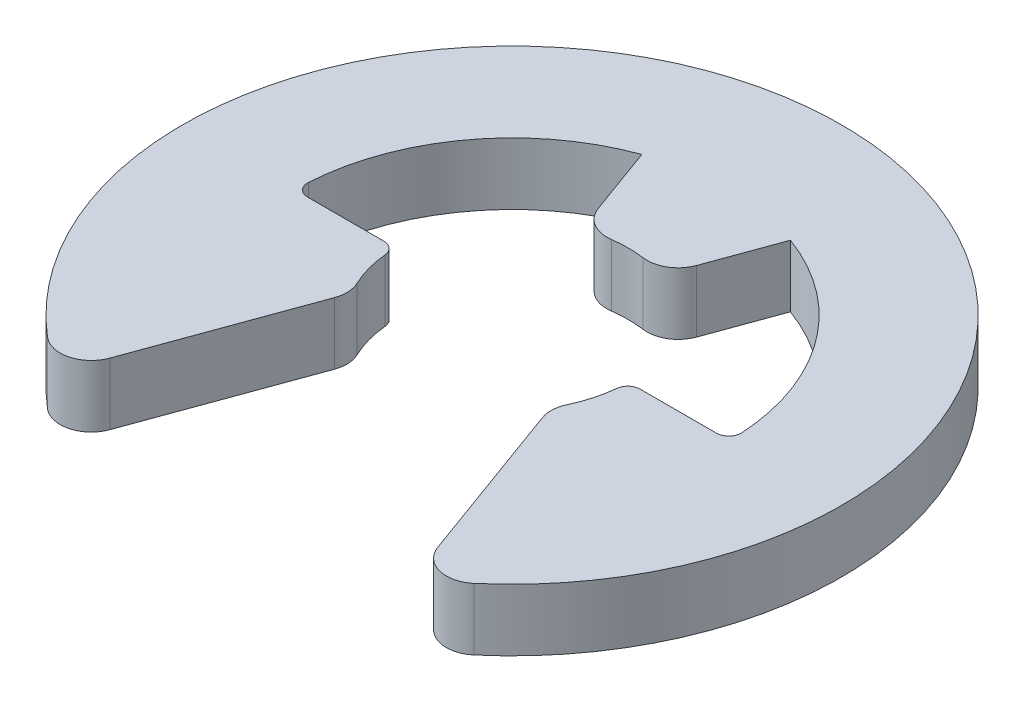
SolidWorks part; units mm, degrees
ref_plane "Front Plane" through (0, 0, 0) normal (0, 0, 1) x (1, 0, 0)
ref_plane "Top Plane" through (0, 0, 0) normal (0, 1, 0) x (1, 0, 0)
ref_plane "Right Plane" through (0, 0, 0) normal (1, 0, 0) x (0, 0, -1)
sketch "Sketch2" plane through (0, 0, 0) normal (0, 1, 0) x (1, 0, 0)
  line L0 (-1.1484, -1.7879) -> (-0.64, -0.391)
  line L2 (0.64, -0.391) -> (1.1484, -1.7879)
  line L4 (-0.75, 0) -> (-1.4, 0)
  line L5 (0.75, 0) -> (1.4, 0)
  line L6 (-0.4788, 1.3156) -> (-0.2565, 0.7048)
  line L8 (0.2565, 0.7048) -> (0.4788, 1.3156)
  arc A0 (1.1484, -1.7879) -> (-1.1484, -1.7879) centre (0, 0) ccw
  arc A1 (0.64, -0.391) -> (0.75, 0) centre (0, 0) ccw
  arc A2 (1.4, 0) -> (0.4788, 1.3156) centre (0, 0) ccw
  arc A3 (-0.75, 0) -> (-0.64, -0.391) centre (0, 0) ccw
  arc A4 (0.2565, 0.7048) -> (-0.2565, 0.7048) centre (0, 0) ccw
  arc A5 (-0.4788, 1.3156) -> (-1.4, 0) centre (0, 0) ccw
  point P15 (0, 0)
  point P16 (0, 0.75)
  dimension "D1" = 4.25
  dimension "D2" = 1.5
  dimension "D3" = 2.8
  dimension "D4" = 70
  dimension "D5" = 70
  dimension "D6" = 1.28
  dimension "D7" = 40
extrude "Boss-Extrude1" add sketch "Sketch2" along normal mid plane 0.4
fillet "Fillet1" radius 0.2 6 edges at (0.64, 0, 0.391) (-0.64, 0, 0.391) (0.2565, 0, -0.7048) (-0.2565, 0, -0.7048) (1.1484, 0, 1.7879) (-1.1484, 0, 1.7879)
fillet "Fillet2" radius 0.08 4 edges at (1.4, 0, 0) (0.75, 0, 0) (-1.4, 0, 0) (-0.75, 0, 0)
